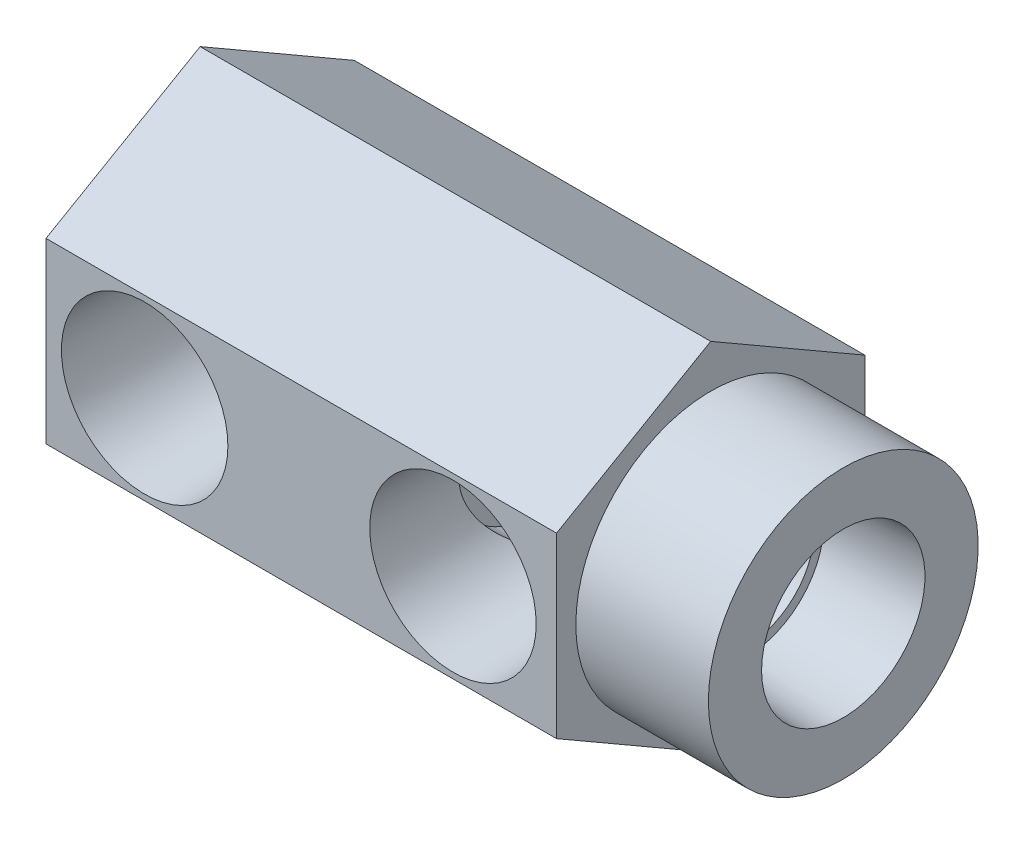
SolidWorks part; units mm, degrees
ref_plane "Front Plane" through (0, 0, 0) normal (0, 0, 1) x (1, 0, 0)
ref_plane "Top Plane" through (0, 0, 0) normal (0, 1, 0) x (1, 0, 0)
ref_plane "Right Plane" through (0, 0, 0) normal (1, 0, 0) x (0, 0, -1)
sketch "Sketch1" plane through (0, 0, 0) normal (1, 0, 0) x (0, 0, -1)
  line L0 (0, 16.1312) -> (0, -16.1312) construction
  line L1 (-12.7, -7.3323) -> (0, -14.6647)
  line L2 (0, -14.6647) -> (12.7, -7.3323)
  line L3 (12.7, -7.3323) -> (12.7, 7.3323)
  line L4 (12.7, 7.3323) -> (0, 14.6647)
  line L5 (0, 14.6647) -> (-12.7, 7.3323)
  line L6 (-12.7, 7.3323) -> (-12.7, -7.3323)
  circle A0 centre (0, 0) radius 12.7 construction
  dimension "D1" = 25.4
extrude "Boss-Extrude1" add sketch "Sketch1" along normal blind 42.0624 separate body
sketch "Sketch2" plane through (0, 0, 0) normal (1, 0, 0) x (0, 0, -1)
  circle A1 centre (0, 0) radius 11.1125
  dimension "D1" = 22.225
extrude "Boss-Extrude2" add sketch "Sketch2" along normal blind 52.9844
hole_wizard "5/16-24 Tapped Hole1" positions "Sketch4" profile "Sketch3" tap size "5/16-24" standard "ANSI Inch"
sketch "Sketch4" plane through (52.9844, 0, 0) normal (1, 0, 0) x (0, 0, -1)
  circle A0 centre (0, 0) radius 11.1125 construction
  point P0 (0, 0)
sketch "Sketch3" plane through (52.9844, 0, 0) normal (0, 1, 0) x (0, 0, -1)
  line L0 (0, 0) -> (0, 43.3532)
  line L1 (0, 43.3532) -> (3.4544, 41.2775)
  line L2 (3.4544, 41.2775) -> (3.4544, 36.576)
  line L3 (3.4544, 36.576) -> (3.9687, 36.576)
  line L4 (3.9687, 36.576) -> (3.9688, 0)
  line L5 (3.9688, 0) -> (0, 0)
  line L10 (0, 43.3532) -> (-3.4544, 41.2775) construction
  line L11 (0, -6.35) -> (0, 107.95) construction
  dimension "Tap Drill Dia." = 6.9088
  dimension "Tap Drill Depth" = 41.2775
  dimension "Thread Major Dia." = 7.9375
  dimension "Thread Depth" = 36.576
  dimension "Drill Angle" = 118
hole_wizard "7/32 (0.21875) Diameter Hole1" positions "Sketch6" profile "Sketch5" hole size "7/32" standard "Ansi Inch"
sketch "Sketch6" plane through (52.9844, 0, 0) normal (1, 0, 0) x (0, 0, -1)
  circle A0 centre (0, 0) radius 11.1125 construction
  point P0 (0, 0)
sketch "Sketch5" plane through (52.9844, 0, 0) normal (0, 1, 0) x (0, 0, -1)
  line L0 (0, 0) -> (0, 46.1193)
  line L1 (0, 46.1193) -> (2.7781, 44.45)
  line L2 (2.7781, 44.45) -> (2.7781, 0)
  line L5 (2.7781, 0) -> (0, 0)
  line L10 (0, 46.1193) -> (-2.7781, 44.45) construction
  line L11 (0, -6.35) -> (0, 107.95) construction
  dimension "Hole Dia." = 5.5562
  dimension "Hole Depth" = 44.45
  dimension "Drill Angle" = 118
hole_wizard "1/4 NPT Tapped Hole1" positions "Sketch8" profile "Sketch7" size "1/4" standard "Ansi Inch"
sketch "Sketch8" plane through (0, 0, 12.7) normal (0, 0, 1) x (1, 0, 0)
  line L0 (13.97, 0) -> (-13.97, 0) construction
  line L1 (0, -13.97) -> (0, 13.97) construction
  point P0 (8.128, 0)
  point P1 (33.528, 0)
  dimension "D1" = 8.128
  dimension "D2" = 25.4
sketch "Sketch7" plane through (8.128, 0, 12.7) normal (1, 0, 0) x (0, -1, 0)
  line L0 (0, 0) -> (0, 20.4111)
  line L1 (5.5626, 17.0688) -> (0, 20.4111)
  line L2 (-5.5626, 17.0688) -> (0, 20.4111) construction
  line L3 (5.5626, 17.0688) -> (5.5626, 10.0203)
  line L4 (5.5626, 10.0203) -> (6.558, 10.0203)
  line L5 (6.558, 10.0203) -> (6.858, 0)
  line L6 (-6.558, 10.0203) -> (-6.858, 0) construction
  line L7 (6.858, 0) -> (0, 0)
  line L8 (0, -6.35) -> (0, 107.95) construction
  line L11 (-5.5626, 10.0203) -> (-6.558, 10.0203) construction
  dimension "Tap Drill Dia." = 11.1252
  dimension "Tap Drill Depth" = 17.0688
  dimension "Thread Dia." = 13.716
  dimension "Thread Angle" = 3.43
  dimension "Thread Depth" = 10.0203
  dimension "Drill Angle" = 118
hole_wizard "1/4 NPT Tapped Hole2" positions "Sketch10" profile "Sketch9" size "1/4" standard "Ansi Inch"
sketch "Sketch10" plane through (0, 0, -12.7) normal (0, 0, -1) x (-1, 0, 0)
  circle A0 centre (-8.128, 0) radius 6.858 construction
  point P0 (-8.128, 0)
sketch "Sketch9" plane through (8.128, 0, -12.7) normal (1, 0, 0) x (0, 1, 0)
  line L0 (0, 0) -> (0, 20.4111)
  line L1 (5.5626, 17.0688) -> (0, 20.4111)
  line L2 (-5.5626, 17.0688) -> (0, 20.4111) construction
  line L3 (5.5626, 17.0688) -> (5.5626, 10.0203)
  line L4 (5.5626, 10.0203) -> (6.558, 10.0203)
  line L5 (6.558, 10.0203) -> (6.858, 0)
  line L6 (-6.558, 10.0203) -> (-6.858, 0) construction
  line L7 (6.858, 0) -> (0, 0)
  line L8 (0, -6.35) -> (0, 107.95) construction
  line L11 (-5.5626, 10.0203) -> (-6.558, 10.0203) construction
  dimension "Tap Drill Dia." = 11.1252
  dimension "Tap Drill Depth" = 17.0688
  dimension "Thread Dia." = 13.716
  dimension "Thread Angle" = 3.43
  dimension "Thread Depth" = 10.0203
  dimension "Drill Angle" = 118
sketch "Sketch11" plane through (0, 0, 0) normal (0, 0, 1) x (1, 0, 0)
  line L3 (52.9844, 6.731) -> (45.0596, 6.3157)
  line L4 (45.0596, 5.5499) -> (45.0596, 6.3157)
  line L5 (45.0596, 5.5499) -> (26.7906, 5.5499)
  line L6 (52.9844, -11.1125) -> (52.9844, 11.1125) construction
  line L7 (52.9844, 0) -> (52.9844, 6.731)
  line L8 (0, 0) -> (50000, 0) construction
  line L9 (0, 7.3323) -> (0, -7.3323) construction
  line L10 (26.7906, 0) -> (26.7906, 5.5499)
  line L11 (26.7906, 0) -> (52.9844, 0)
  point P11 (0, 0)
  dimension "D1" = 26.1937
  dimension "D2" = 13.462
  dimension "D3" = 11.0998
  dimension "D4" = 7.9248
  dimension "D5" = 3
revolve "Cut-Revolve1" cut sketch "Sketch11" angle 360 about L8
